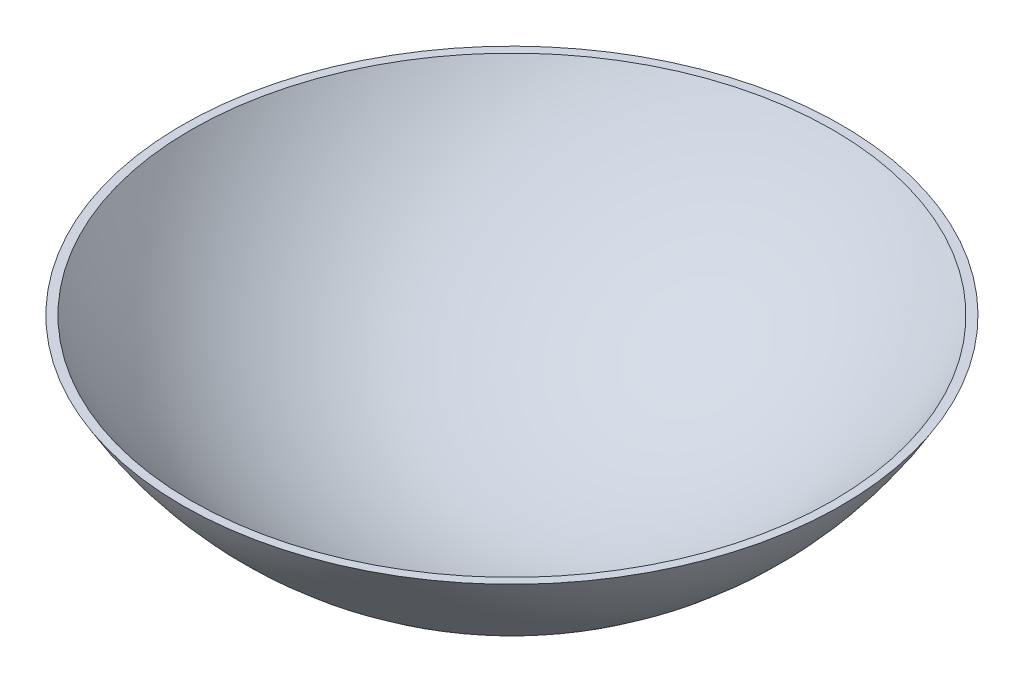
SolidWorks part; units mm, degrees
ref_plane "Front Plane" through (0, 0, 0) normal (0, 0, 1) x (1, 0, 0)
ref_plane "Top Plane" through (0, 0, 0) normal (0, 1, 0) x (1, 0, 0)
ref_plane "Right Plane" through (0, 0, 0) normal (1, 0, 0) x (0, 0, -1)
sketch "Sketch1" plane through (0, 0, 0) normal (0, 0, 1) x (1, 0, 0)
  line L1 (43.3013, -25) -> (44.4522, -25)
  line L2 (0, 0) -> (0, -50) construction
  line L3 (0, -50) -> (0, -51)
  arc A0 (0, -50) -> (43.3013, -25) centre (0, 0) ccw
  arc A1 (0, -51) -> (44.4522, -25) centre (0, 0) ccw
  circle A2 centre (0, 0) radius 51 construction
  circle A3 centre (0, 0) radius 50 construction
  dimension "D1" = 100
  dimension "D3" = 25
  dimension "D2" = 1
revolve "Revolve4" add sketch "Sketch1" angle 360 about L2
sketch "Sketch2" plane through (0, 0, 0) normal (0, 1, 0) x (1, 0, 0)
  circle A0 centre (0, 0) radius 0.0005
  dimension "D1" = 0.001
extrude "Extrude1" cut sketch "Sketch2" against normal through all
